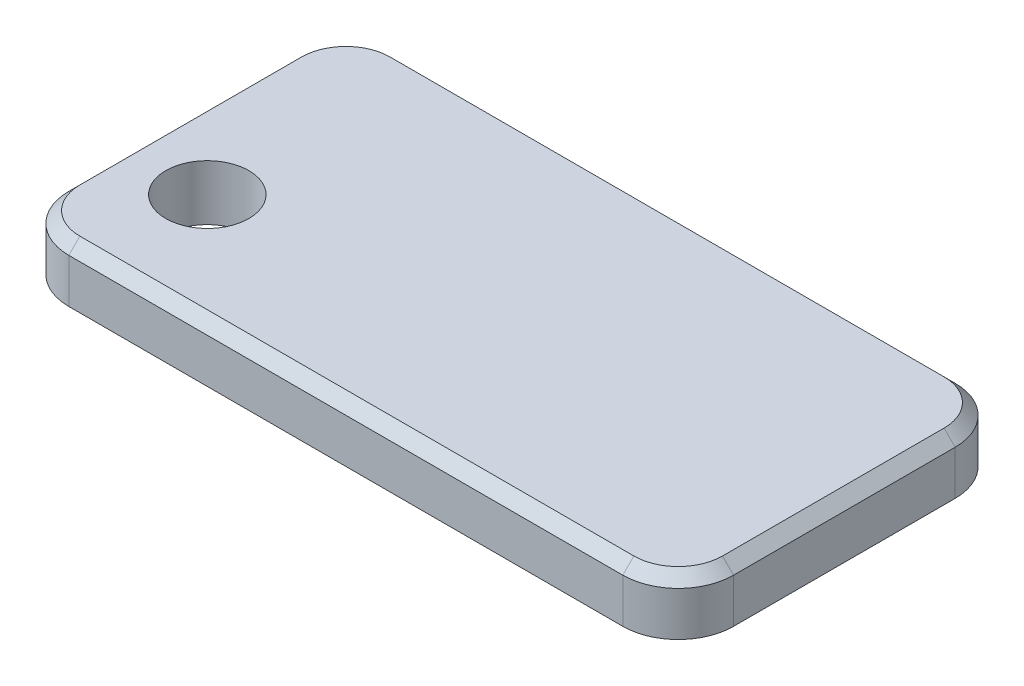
SolidWorks part; units mm, degrees
ref_plane "Front Plane" through (0, 0, 0) normal (0, 0, 1) x (1, 0, 0)
ref_plane "Top Plane" through (0, 0, 0) normal (0, 1, 0) x (1, 0, 0)
ref_plane "Right Plane" through (0, 0, 0) normal (1, 0, 0) x (0, 0, -1)
sketch "Sketch1" plane through (0, 0, 0) normal (0, 1, 0) x (1, 0, 0)
  line L1 (0, 0) -> (152.4, 0)
  line L2 (0, 0) -> (0, 76.2)
  line L3 (0, 76.2) -> (152.4, 76.2)
  line L4 (152.4, 0) -> (152.4, 76.2)
  dimension "D1" = 76.2
  dimension "D2" = 152.4
extrude "Extrude1" add sketch "Sketch1" along normal blind 12.7
sketch "Sketch2" plane through (0, 12.7, 0) normal (0, 1, 0) x (-1, 0, 0)
  line L0 (0, -76.2) -> (0, 0) construction
  line L1 (0, 0) -> (-152.4, 0) construction
  circle A0 centre (-19.0525, -25.4) radius 9.525
  dimension "D1" = 19.05
  dimension "D2" = 19.0525
  dimension "D3" = 25.4
extrude "Cut-Extrude1" cut sketch "Sketch2" against normal through all
fillet "Fillet1" radius 12.7 4 edges at (0, 6.35, -76.2) (152.4, 6.35, -76.2) (152.4, 6.35, 0) (0, 6.35, 0)
chamfer "Chamfer1" distance 2.54 angle 45 8 edges at (76.2, 12.7, -76.2) (152.4, 12.7, -38.1) (0, 12.7, -38.1) (76.2, 12.7, 0) (3.7197, 12.7, -72.4803) (3.7197, 12.7, -3.7197) (148.6803, 12.7, -3.7197) (148.6803, 12.7, -72.4803)
